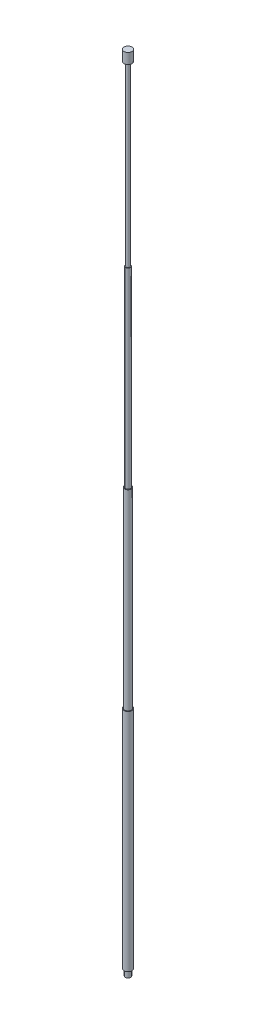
SolidWorks part; units mm, degrees
ref_plane "Plan de face" through (0, 0, 0) normal (0, 0, 1) x (1, 0, 0)
ref_plane "Plan de dessus" through (0, 0, 0) normal (0, 1, 0) x (1, 0, 0)
ref_plane "Plan de droite" through (0, 0, 0) normal (1, 0, 0) x (0, 0, -1)
sketch "Esquisse1" plane through (0, 0, 0) normal (0, 1, 0) x (1, 0, 0)
  circle A0 centre (0, 0) radius 2.125
  dimension "D1" = 4.25
extrude "Extrusion1" add sketch "Esquisse1" along normal blind 120
sketch "Esquisse2" plane through (0, 120, 0) normal (0, 1, 0) x (-1, 0, 0)
  circle A0 centre (0, 0) radius 1.725
  dimension "D1" = 3.45
extrude "Extrusion2" add sketch "Esquisse2" along normal blind 102
sketch "Esquisse3" plane through (0, 222, 0) normal (0, 1, 0) x (-1, 0, 0)
  circle A0 centre (0, 0) radius 1.325
  dimension "D1" = 2.65
extrude "Extrusion3" add sketch "Esquisse3" along normal blind 102
sketch "Esquisse4" plane through (0, 324, 0) normal (0, 1, 0) x (-1, 0, 0)
  circle A0 centre (0, 0) radius 0.925
  dimension "D1" = 1.85
extrude "Extrusion4" add sketch "Esquisse4" along normal blind 100
sketch "Esquisse5" plane through (0, 424, 0) normal (0, 1, 0) x (-1, 0, 0)
  circle A0 centre (0, 0) radius 2.125
  dimension "D1" = 4.25
extrude "Extrusion5" add sketch "Esquisse5" against normal blind 5.6
sketch "Esquisse6" plane through (0, 0, 0) normal (0, -1, 0) x (1, 0, 0)
  circle A0 centre (0, 0) radius 1.435
  dimension "D1" = 2.87
extrude "Extrusion6" add sketch "Esquisse6" along normal blind 3.4
